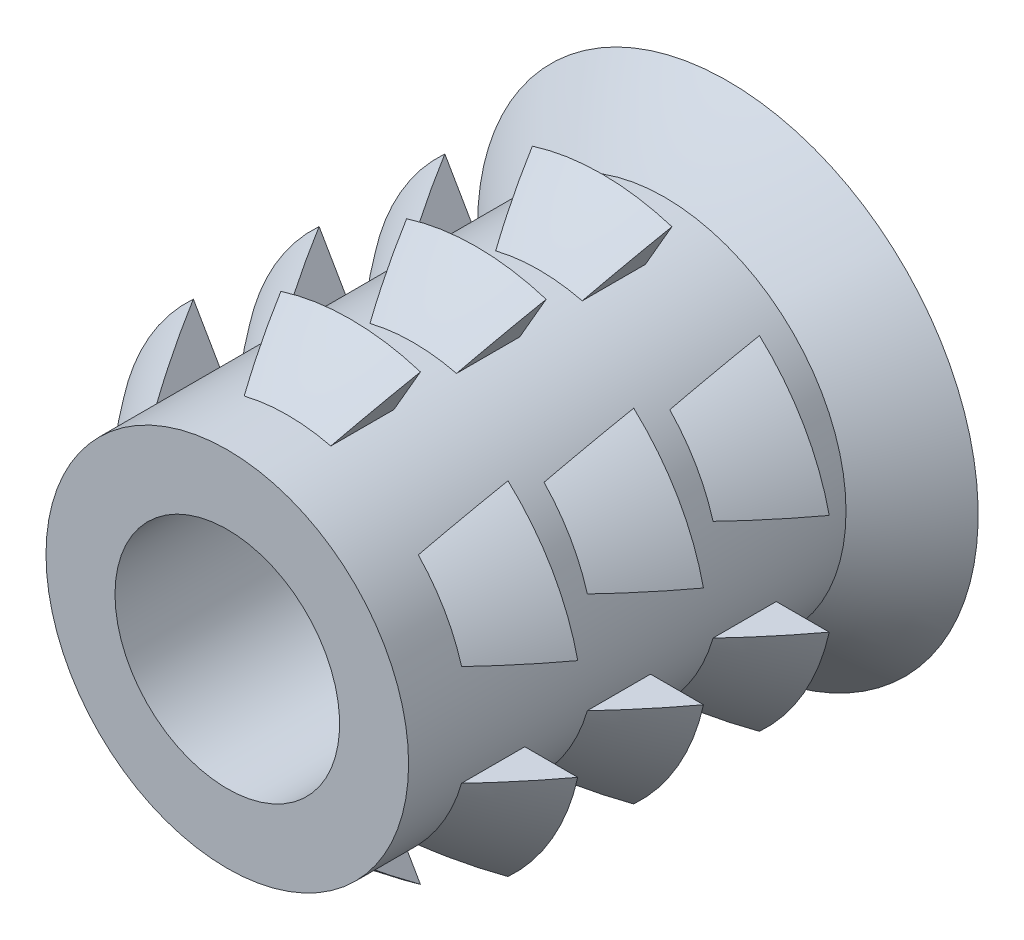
SolidWorks part; units mm, degrees
other "<insert 2-56(256S5-6)11>-<Imported1>"
ref_plane "Front Plane" through (0, 0, 0) normal (0, 0, 1) x (1, 0, 0)
ref_plane "Top Plane" through (0, 0, 0) normal (0, 1, 0) x (1, 0, 0)
ref_plane "Right Plane" through (0, 0, 0) normal (1, 0, 0) x (0, 0, -1)
inserted part "insert 2-56(256S5-6)"
